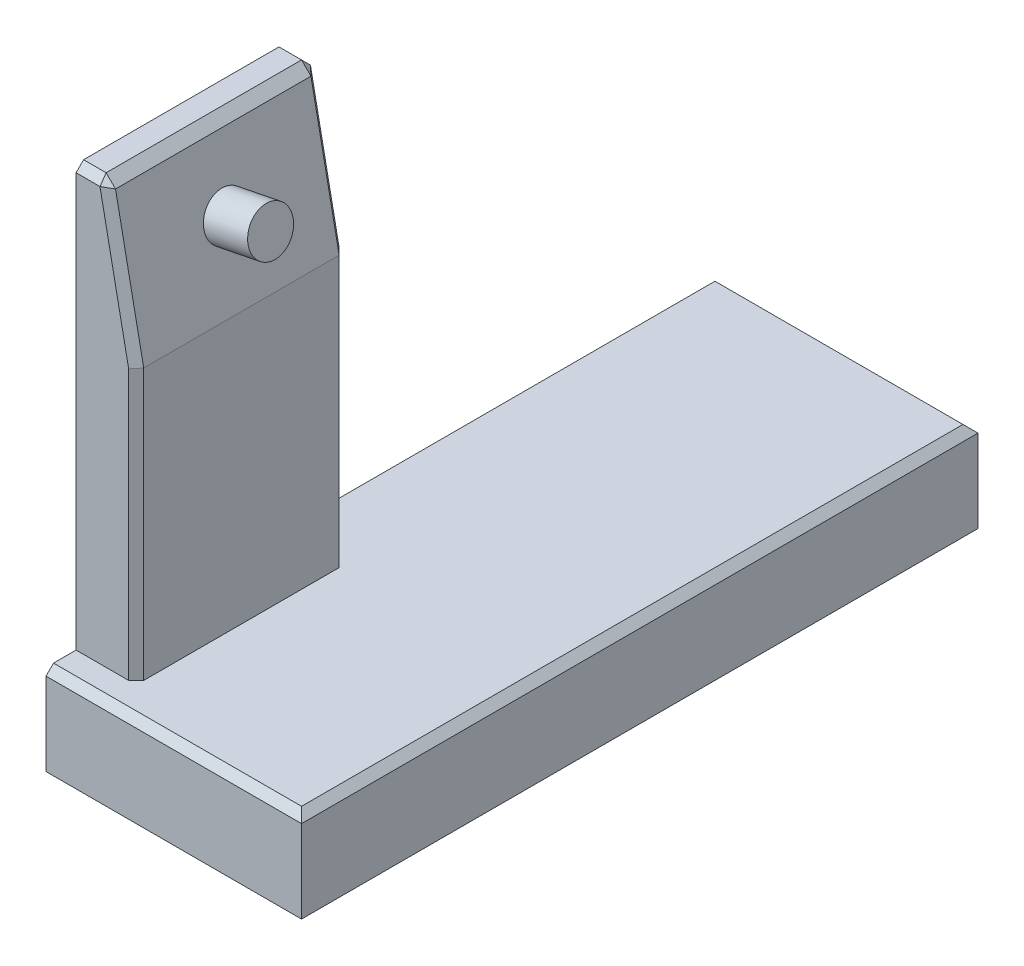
SolidWorks part; units mm, degrees
ref_plane "Front Plane" through (0, 0, 0) normal (0, 0, 1) x (1, 0, 0)
ref_plane "Top Plane" through (0, 0, 0) normal (0, 1, 0) x (1, 0, 0)
ref_plane "Right Plane" through (0, 0, 0) normal (1, 0, 0) x (0, 0, -1)
sketch "Sketch1" plane through (0, 0, 0) normal (0, 1, 0) x (1, 0, 0)
  line L1 (0, 0) -> (17, 0)
  line L2 (0, 0) -> (0, 45)
  line L3 (0, 45) -> (17, 45)
  line L4 (17, 0) -> (17, 45)
  dimension "D1" = 17
  dimension "D2" = 45
extrude "Boss-Extrude1" add sketch "Sketch1" along normal blind 6
sketch "Sketch2" plane through (0, 6, 0) normal (0, 1, 0) x (1, 0, 0)
  line L0 (0, 45) -> (0, 0) construction
  line L1 (0, 2) -> (4, 2)
  line L2 (0, 2) -> (0, 16)
  line L3 (0, 16) -> (4, 16)
  line L4 (4, 2) -> (4, 16)
  point P6 (0, 0)
  dimension "D1" = 4
  dimension "D2" = 14
  dimension "D3" = 2
extrude "Boss-Extrude2" add sketch "Sketch2" along normal blind 28
sketch "Sketch3" plane through (0, 0, -2) normal (0, 0, 1) x (1, 0, 0)
  line L0 (4, 34) -> (2, 34)
  line L1 (0, 34) -> (4, 34) construction
  line L2 (2, 34) -> (4, 24)
  line L3 (4, 34) -> (4, 6) construction
  line L4 (4, 24) -> (4, 34)
  dimension "D1" = 2
  dimension "D2" = 10
extrude "Cut-Extrude1" cut sketch "Sketch3" against normal blind 14
sketch "Sketch4" plane through (0, 0, 0) normal (0, -1, 0) x (1, 0, 0)
  line L0 (9, 0) -> (9, -45) construction
  line L1 (0, 0) -> (17, 0) construction
  line L2 (17, -45) -> (0, -45) construction
  line L3 (17, 0) -> (17, -45) construction
  circle A0 centre (9, -11.25) radius 4
  circle A1 centre (9, -33.75) radius 4
  dimension "D4" = 8
  dimension "D5" = 8
  dimension "D1" = 8
  dimension "D2" = 11.25
  dimension "D3" = 11.25
extrude "Cut-Extrude2" cut sketch "Sketch4" against normal blind 5
sketch "Sketch5" plane through (8.4615, 1.6923, 0) normal (0.9806, 0.1961, 0) x (0, 0, -1)
  line L0 (16, 32.9475) -> (2, 22.7495) construction
  line L1 (2, 22.7495) -> (2, 32.9475) construction
  line L2 (2, 32.9475) -> (16, 22.7495) construction
  circle A0 centre (9, 27.8485) radius 1.5
  dimension "D1" = 3
extrude "Boss-Extrude3" add sketch "Sketch5" along normal blind 3
chamfer "Chamfer1" distance 0.5 angle 45 10 edges at (2, 34, -9) (1, 34, -16) (4, 15, -16) (3, 29, -16) (1, 34, -2) (3, 29, -2) (4, 15, -2) (8.5, 6, 0) (8.5, 6, -45) (17, 6, -22.5)
